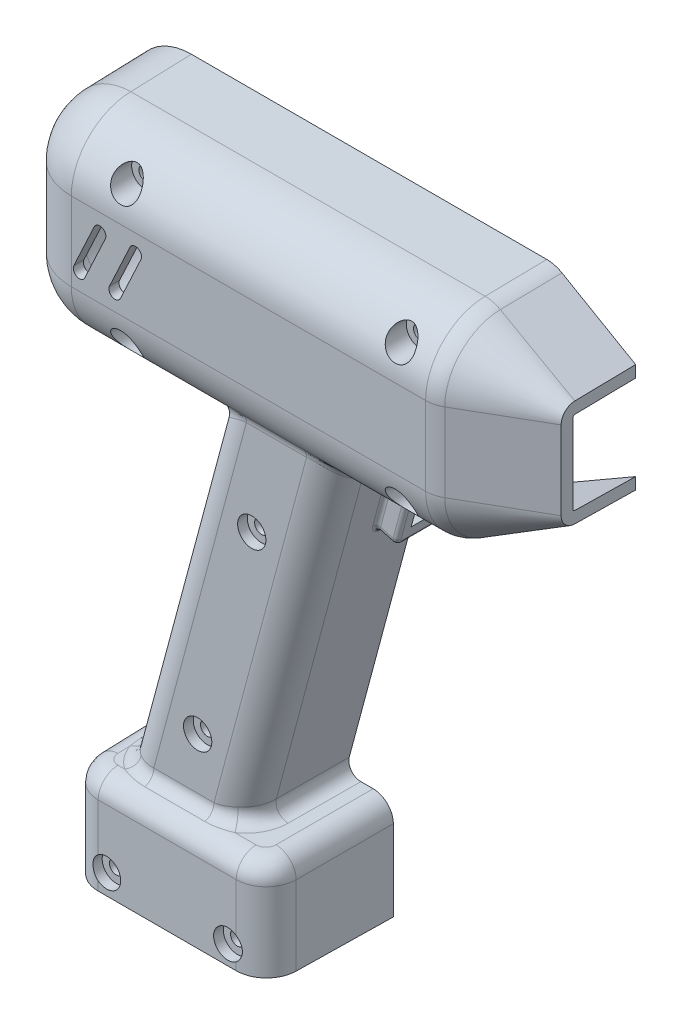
SolidWorks part; units mm, degrees
ref_plane "Ebene vorne" through (0, 0, 0) normal (0, 0, 1) x (1, 0, 0)
ref_plane "Ebene oben" through (0, 0, 0) normal (0, 1, 0) x (1, 0, 0)
ref_plane "Ebene rechts" through (0, 0, 0) normal (1, 0, 0) x (0, 0, -1)
sketch "Skizze1" plane through (0, 0, 0) normal (0, 0, 1) x (1, 0, 0)
  line L0 (55, 0) -> (-55, 0) construction
  line L1 (-25, 0) -> (25, 0)
  line L2 (-25, 0) -> (-25, 25)
  line L3 (-25, 25) -> (25, 25)
  line L4 (25, 0) -> (25, 25)
  line L5 (0, -9.5998) -> (0, 35.5758) construction
  line L6 (0, -55) -> (0, 55) construction
  dimension "D1" = 50
  dimension "D2" = 25
extrude "Aufsatz-Linear austragen1" add sketch "Skizze1" along normal blind 31
sketch "Skizze2" plane through (0, 0, 0) normal (0, 0, 1) x (1, 0, 0)
  line L0 (25, 25) -> (-25, 25) construction
  line L1 (-18, 25) -> (13.0583, 25)
  line L2 (-18, 25) -> (4.7757, 110)
  line L3 (4.7757, 110) -> (35.834, 110)
  line L4 (13.0583, 25) -> (35.834, 110)
  line L5 (0, -13.75) -> (0, 13.75) construction
  point P6 (29.2725, 110)
  point P7 (-16.7981, 25)
  point P11 (0, 60.8353)
  dimension "D1" = 30
  dimension "D2" = 85
  dimension "D3" = 18
  dimension "D4" = 75
extrude "Aufsatz-Linear austragen2" add sketch "Skizze2" along normal blind 25
sketch "Skizze3" plane through (0, 0, 0) normal (0, 0, 1) x (1, 0, 0)
  line L2 (35.834, 110) -> (4.7757, 110) construction
  line L3 (-40, 110) -> (85, 110)
  line L4 (-40, 110) -> (-40, 160)
  line L7 (-40, 160) -> (85, 160)
  line L8 (85, 110) -> (85, 160)
  line L9 (0, -13.75) -> (0, 13.75) construction
  dimension "D1" = 50
  dimension "D2" = 85
  dimension "D3" = 40
extrude "Aufsatz-Linear austragen3" add sketch "Skizze3" along normal blind 30
sketch "Skizze4" plane through (5.9335, -1.5899, 0) normal (0.9659, -0.2588, 0) x (0, 0, -1)
  line L0 (0, 68.75) -> (0, -68.75) construction
  line L1 (0, 95.6186) -> (-10, 95.6186)
  line L2 (0, 95.6186) -> (0, 120.6186)
  line L3 (0, 120.6186) -> (-10, 120.6186)
  line L4 (-10, 95.6186) -> (-10, 120.6186)
  line L5 (-31, 30.6186) -> (0, 30.6186) construction
  point P6 (0, 108.1186)
  point P8 (-13.4172, 107.3742)
  dimension "D1" = 10
  dimension "D2" = 25
  dimension "D3" = 65
extrude "Aufsatz-Linear austragen4" add sketch "Skizze4" along normal blind 5
draft "Formschräge1" type of draft neutral plane draft angle 1 faces to draft 8 parameters "D1"=1
fillet "Verrundung1" radius 15 2 edges at (22.7618, 159.4763, 30) (22.7618, 110.5237, 30)
fillet "Verrundung2" radius 15 5 edges at (-39.8668, 159.8668, 7.6309) (-39.5514, 155.2495, 25.6988) (-39.8668, 110.1332, 7.6309) (-39.5514, 114.7505, 25.6988) (-39.4763, 135, 30)
chamfer "Fase1" distance 20 angle 30 5 edges at (85, 110.1332, 7.6309) (85, 159.8668, 7.6309) (85, 114.7505, 25.6988) (85, 155.2495, 25.6988) (85, 135, 30)
fillet "Verrundung4" radius 7.5 5 edges at (65, 110.1332, 7.6309) (65, 114.7505, 25.6988) (65, 159.8668, 7.6309) (65, 155.2495, 25.6988) (65, 135, 30)
fillet "Verrundung3" radius 7.5 4 edges at (-5.6717, 69.3237, 25) (24.483, 69.3237, 25) (-24.4589, 12.2294, 31) (24.4589, 12.2294, 31)
fillet "Verrundung5" radius 5 5 edges at (-24.7938, 24.7938, 11.8154) (-22.3455, 24.4964, 28.8494) (0, 24.4589, 31) (22.3455, 24.4964, 28.8494) (24.7938, 24.7938, 11.8154)
fillet "Verrundung6" radius 3 12 edges at (-17.8819, 24.8461, 8.8154) (-15.4671, 24.6012, 22.8494) (-2.5878, 24.5636, 25) (10.3117, 24.6012, 22.8494) (12.8578, 24.8461, 8.8154) (35.6648, 110.2205, 12.6309) (35.6263, 110.3344, 16.4509) (33.9697, 112.4043, 22.7218) (21.3991, 114.0838, 25) (6.9878, 111.8847, 21.7817) (5.1626, 110.3344, 16.4509) (4.9493, 110.1332, 7.6309)
fillet "Verrundung7" radius 1.5 1 edges at (33.012, 90.1461, 10)
fillet "Verrundung8" radius 1 3 edges at (35.5111, 89.4765, 4.25) (35.6248, 89.9009, 9.5607) (38.4782, 100.55, 10)
fillet "Verrundung9" radius 1 7 edges at (41.0314, 110.0785, 4.5) (40.7525, 110.1694, 9.7071) (39.0118, 110.1746, 10) (36.1756, 109.5547, 10) (30.6098, 90.7898, 4.25) (30.634, 91.2382, 9.5607) (33.0027, 100.108, 10)
shell "Schale1" thickness 2.5
sketch "Skizze5" plane through (0, 0, 30) normal (0, 0, 1) x (1, 0, 0)
  line L0 (-22.7539, 129.4969) -> (-17.6824, 140.3726) construction
  line L1 (-24.1133, 130.1308) -> (-19.0419, 141.0065)
  line L2 (-21.3944, 128.863) -> (-16.323, 139.7387)
  line L3 (-13.9268, 129.4969) -> (-8.8554, 140.3726) construction
  line L4 (-15.2863, 130.1308) -> (-10.2149, 141.0065)
  line L5 (-12.5674, 128.863) -> (-7.4959, 139.7387)
  line L6 (-48.7499, 134.9347) -> (25.9677, 134.9347) construction
  arc A0 (-24.1133, 130.1308) -> (-21.3944, 128.863) centre (-22.7539, 129.4969) ccw
  arc A1 (-16.323, 139.7387) -> (-19.0419, 141.0065) centre (-17.6824, 140.3726) ccw
  arc A2 (-15.2863, 130.1308) -> (-12.5674, 128.863) centre (-13.9268, 129.4969) ccw
  arc A3 (-7.4959, 139.7387) -> (-10.2149, 141.0065) centre (-8.8554, 140.3726) ccw
  point P2 (-20.2181, 134.9347)
  point P7 (-11.3911, 134.9347)
  point P16 (0, 0)
  point P17 (0, 0)
  point P20 (0, 0)
  point P21 (0, 0)
  point P22 (0, 0)
  dimension "D1" = 12
  dimension "D2" = 12
  dimension "D3" = 8
  dimension "D4" = 3
  dimension "D5" = 3
  dimension "D6" = 65
extrude "Schnitt-Linear austragen1" cut sketch "Skizze5" against normal up to surface (2.5 mm away)
sketch "Skizze6" plane through (10.7632, -2.884, 0) normal (0.9659, -0.2588, 0) x (0, 0, -1)
  line L0 (0, 96.6186) -> (0, 116.0986) construction
  line L1 (0, 99.1186) -> (-7, 99.1186)
  line L2 (0, 99.1186) -> (0, 115.1617)
  line L3 (0, 115.1617) -> (-7, 115.1617)
  line L4 (-7, 99.1186) -> (-7, 115.1617)
  line L5 (-8.5, 96.6186) -> (0, 96.6186) construction
  line L6 (0, 116.0986) -> (-9, 116.2613) construction
  point P6 (0, 107.1402)
  point P9 (-3.5, 99.1186)
  point P12 (-3.5, 115.1617)
  dimension "D1" = 7
  dimension "D2" = 2.5
  dimension "D3" = 1
extrude "Schnitt-Linear austragen2" cut sketch "Skizze6" against normal up to surface (2.5 mm away)
sketch "Skizze7" plane through (0, 0, 0) normal (0, 0, -1) x (-1, 0, 0)
  line L0 (-71.6404, 152) -> (97.6404, 152) construction
  line L1 (-65.4904, 118) -> (-44.5096, 118) construction
  line L2 (-65.4904, 125.2641) -> (-65.4904, 113.4358) construction
  line L3 (-3.721, 48.1082) -> (-26.1707, 131.8918) construction
  line L4 (-33.6495, 5) -> (48.32, 5) construction
  line L5 (-5.5903, 27.2914) -> (-28.506, 112.8142) construction
  line L6 (-13.6117, 112.8142) -> (9.304, 27.2914) construction
  line L7 (17.05, 0) -> (-17.05, 0) construction
  line L8 (-96.83, 135) -> (59.0566, 135) construction
  line L9 (-62.9904, 144.7359) -> (24.7359, 144.7359) construction
  line L10 (24.7359, 125.2641) -> (-62.9904, 125.2641) construction
  line L11 (0, 17.05) -> (0, -17.05) construction
  circle A0 centre (-55, 152) radius 3.5
  circle A1 centre (-55, 118) radius 3.3036
  circle A2 centre (13, 118) radius 3.5
  circle A3 centre (13, 152) radius 3.5
  circle A4 centre (-14.9458, 90) radius 3.5
  circle A5 centre (-1.5484, 40) radius 3.5
  circle A6 centre (-15, 4.7408) radius 3.5
  circle A7 centre (15, 5) radius 3.5
  dimension "D1" = 6.6071
  dimension "D2" = 7
  dimension "D3" = 7
  dimension "D4" = 7
  dimension "D5" = 7
  dimension "D6" = 7
  dimension "D7" = 7
  dimension "D8" = 7
  dimension "D9" = 5
  dimension "D10" = 17
  dimension "D11" = 17
  dimension "D12" = 55
  dimension "D13" = 55
  dimension "D14" = 13
  dimension "D15" = 13
  dimension "D16" = 90
  dimension "D17" = 40
  dimension "D18" = 15
  dimension "D19" = 15
extrude "Aufsatz-Linear austragen5" add sketch "Skizze7" against normal up to next
draft "Formschräge2" type of draft neutral plane draft angle 1 faces to draft 8 parameters "D1"=1
fillet "Verrundung15" radius 0.5 10 edges at (51.0671, 152.182, 25.0402) (-16.9329, 152.182, 25.0402) (51.4575, 119.2502, 25.9582) (-16.7323, 119.3042, 25.9877) (11.0531, 90, 22.5) (-2.3444, 40, 22.5) (18.9888, 4.8724, 28.1249) (-18.9888, 4.8684, 28.1249) (11.0025, 4.7408, 28.5) (-11.0025, 5, 28.5)
sketch "Skizze8" plane through (0, 0, 0) normal (0, 0, -1) x (-1, 0, 0)
  circle A0 centre (-15, 4.7408) radius 1.5
  circle A1 centre (15, 5) radius 1.5
  circle A2 centre (-1.5484, 40) radius 1.5
  circle A3 centre (-14.9458, 90) radius 1.5
  circle A4 centre (13, 118) radius 1.5
  circle A5 centre (13, 152) radius 1.5
  circle A6 centre (-55, 118) radius 1.5
  circle A7 centre (-55, 152) radius 1.5
  circle A9 centre (-55, 152) radius 3.5 construction
  dimension "D1" = 3
  dimension "D2" = 3
  dimension "D3" = 3
  dimension "D4" = 3
  dimension "D5" = 3
  dimension "D6" = 3
  dimension "D7" = 3
  dimension "D8" = 3
extrude "Schnitt-Linear austragen3" cut sketch "Skizze8" against normal through all both and the other way through all
hole_wizard "Stirnsenkung für M3 Flachkopfschraube mit Schlitz3" positions "Skizze10" profile "Skizze11" counterbore size "M3" standard "DIN"
sketch "Skizze10" plane through (0, 0, 31) normal (0, 0, 1) x (1, 0, 0)
  point P0 (-15, 5)
  point P3 (15, 4.7408)
sketch "Skizze11" plane through (-15, 5, 31) normal (1, 0, 0) x (0, -1, 0)
  line L0 (0, 0) -> (0, 31)
  line L1 (0, 31) -> (1.7, 31)
  line L3 (1.7, 31) -> (1.7, 2.4)
  line L4 (1.7, 2.4) -> (3.5, 2.4)
  line L5 (3.5, 2.4) -> (3.5, 0)
  line L7 (3.5, 0) -> (0, 0)
  line L11 (0, -6.35) -> (0, 107.95) construction
  dimension "Bohrerdurchmesser" = 3.4
  dimension "Bohrungstiefe" = 31
  dimension "Senkdurchmesser2" = 7
  dimension "Senktiefe2" = 2.4
hole_wizard "Stirnsenkung für M3 Flachkopfschraube mit Schlitz2" positions "Skizze12" profile "Skizze13" counterbore size "M3" standard "DIN"
sketch "Skizze12" plane through (0, 0, 25) normal (0, 0, 1) x (1, 0, 0)
  point P0 (14.9458, 90)
  point P3 (1.5484, 40)
sketch "Skizze13" plane through (14.9458, 90, 25) normal (1, 0, 0) x (0, -1, 0)
  line L0 (0, 0) -> (0, 25)
  line L1 (0, 25) -> (1.7, 25)
  line L3 (1.7, 25) -> (1.7, 2.4)
  line L4 (1.7, 2.4) -> (3.5, 2.4)
  line L5 (3.5, 2.4) -> (3.5, 0)
  line L7 (3.5, 0) -> (0, 0)
  line L11 (0, -6.35) -> (0, 107.95) construction
  dimension "Bohrerdurchmesser" = 3.4
  dimension "Bohrungstiefe" = 25
  dimension "Senkdurchmesser2" = 7
  dimension "Senktiefe2" = 2.4
hole_wizard "Stirnsenkung für M3 Flachkopfschraube mit Schlitz1" positions "Skizze14" profile "Skizze16" counterbore size "M3" standard "DIN"
sketch "Skizze14" plane through (0, 0, 30) normal (0, 0, 1) x (1, 0, 0)
  point P0 (55, 118)
  point P3 (55, 152)
  point P6 (-13, 118)
  point P9 (-13, 152)
sketch "Skizze16" plane through (55, 118, 30) normal (1, 0, 0) x (0, -1, 0)
  line L0 (0, 0) -> (0, 30)
  line L1 (0, 30) -> (1.7, 30)
  line L3 (1.7, 30) -> (1.7, 6.7)
  line L4 (1.7, 6.7) -> (3.5, 6.7)
  line L5 (3.5, 6.7) -> (3.5, 0)
  line L7 (3.5, 0) -> (0, 0)
  line L11 (0, -6.35) -> (0, 107.95) construction
  dimension "Bohrerdurchmesser" = 3.4
  dimension "Bohrungstiefe" = 30
  dimension "Senkdurchmesser2" = 7
  dimension "Senktiefe2" = 6.7
sketch "Skizze17" plane through (0, 0, 0) normal (0, 0, -1) x (-1, 0, 0)
  line L0 (-41.7777, 110) -> (-62.9904, 110) construction
  line L1 (-47, 110) -> (-45, 110)
  line L2 (-47, 110) -> (-47, 157.4996)
  line L3 (-47, 157.4996) -> (-45, 157.4996)
  line L4 (-45, 110) -> (-45, 157.4996)
  line L5 (-62.9904, 157.4996) -> (25.0015, 157.4996) construction
  line L6 (25.0023, 110) -> (-0.8666, 110) construction
  line L7 (2, 110) -> (0, 110)
  line L8 (2, 110) -> (2, 160)
  line L9 (2, 160) -> (0, 160)
  line L10 (0, 110) -> (0, 160)
  line L11 (0, 17.05) -> (0, -17.05) construction
  line L12 (-62.9904, 160) -> (25.0023, 160) construction
  line L13 (-25, 0) -> (-25, 20.0008) construction
  line L14 (-25, 12) -> (25, 12)
  line L15 (-25, 12) -> (-25, 14)
  line L16 (-25, 14) -> (25, 14)
  line L17 (25, 12) -> (25, 14)
  line L18 (17.05, 0) -> (-17.05, 0) construction
  line L19 (25, 20.0008) -> (25, 0) construction
  line L21 (-19.757, 50) -> (10.7654, 50)
  line L22 (-19.757, 50) -> (-19.757, 52)
  line L23 (-19.757, 52) -> (10.7654, 52)
  line L24 (10.7654, 50) -> (10.7654, 52)
  line L25 (-3.7639, 106.2241) -> (17.4058, 27.2175) construction
  line L26 (-27.7955, 80) -> (2.7269, 80)
  line L27 (-27.7955, 80) -> (-27.7955, 82)
  line L28 (-27.7955, 82) -> (2.7269, 82)
  line L29 (2.7269, 80) -> (2.7269, 82)
  line L30 (-14.07, 28.7759) -> (-30.4226, 89.8047) construction
  point P26 (25, 13)
  point P33 (0, 0)
  point P41 (0, 0)
  point P43 (0, 0)
  point P44 (0, 0)
  dimension "D1" = 2
  dimension "D2" = 2
  dimension "D3" = 2
  dimension "D4" = 45
  dimension "D5" = 12
  dimension "D6" = 0
  dimension "D7" = 50
  dimension "D8" = 80
  dimension "D9" = 2
  dimension "D10" = 2
extrude "Aufsatz-Linear austragen6" add sketch "Skizze17" against normal up to next
sketch "Skizze19" plane through (0, 12, 0) normal (0, -1, 0) x (1, 0, 0)
  line L1 (0, -6) -> (0, 10) construction
  line L2 (0, -17.05) -> (0, 17.05) construction
  line L3 (-9.5, -6) -> (-9.5, 10)
  line L4 (9.5, -6) -> (9.5, 10)
  line L5 (68.75, 0) -> (-68.75, 0) construction
  arc A0 (-9.5, -6) -> (9.5, -6) centre (0, -6) ccw
  arc A1 (9.5, 10) -> (-9.5, 10) centre (0, 10) ccw
  point P4 (0, 2)
  dimension "D1" = 19
  dimension "D2" = 10
  dimension "D3" = 6
extrude "Schnitt-Linear austragen4" cut sketch "Skizze19" against normal up to surface (2 mm away)
sketch "Skizze20" plane through (-2, 0, 0) normal (-1, 0, 0) x (0, 0, 1)
  line L0 (0, 133.5) -> (0, 136.5) construction
  line L1 (0, 112.5004) -> (0, 157.4996) construction
  line L2 (-18, 133.5) -> (-18, 136.5)
  line L3 (18, 133.5) -> (18, 136.5)
  line L4 (32.7029, 135) -> (-32.7029, 135) construction
  line L5 (15.2182, 112.766) -> (0, 112.5004) construction
  line L6 (0, 157.4996) -> (15.2182, 157.234) construction
  arc A0 (-18, 133.5) -> (18, 133.5) centre (0, 133.5) ccw
  arc A1 (18, 136.5) -> (-18, 136.5) centre (0, 136.5) ccw
  point P4 (0, 135)
  point P15 (0, 0)
  dimension "D1" = 3
  dimension "D2" = 18
extrude "Schnitt-Linear austragen5" cut sketch "Skizze20" against normal up to surface (49 mm away)
sketch "Skizze21" plane through (0, 82, 0) normal (0, 1, 0) x (1, 0, 0)
  line L0 (-0.1383, 0) -> (25.7428, 0) construction
  circle A0 centre (12.8022, 0) radius 10
  point P2 (0, 0)
  dimension "D1" = 20
extrude "Schnitt-Linear austragen6" cut sketch "Skizze21" against normal up to surface (2 mm away)
sketch "Skizze22" plane through (0, 52, 0) normal (0, 1, 0) x (1, 0, 0)
  line L1 (-8.1768, 0) -> (17.7043, 0) construction
  circle A0 centre (4.7638, 0) radius 10
  point P2 (0, 0)
  dimension "D1" = 20
extrude "Schnitt-Linear austragen7" cut sketch "Skizze22" against normal up to surface (2 mm away)
draft "Formschräge3" type of draft neutral plane draft angle 0.5 faces to draft 10 parameters "D1"=0.5
fillet "Verrundung16" radius 1 50 edges at (22.2938, 11.8971, 11.7936) (20.5932, 11.7638, 27.0663) (0, 11.7513, 28.5) (-20.5932, 11.7638, 27.0663) (16.989, 49.9233, 8.7936) (15.2539, 49.8162, 21.0663) (4.1753, 49.8036, 22.5) (-6.8967, 49.8162, 21.0663) (25.0274, 79.9233, 8.7936) (23.2924, 79.8162, 21.0663) (12.2137, 79.8036, 22.5) (1.1418, 79.8162, 21.0663) (22.2938, 14.1029, 11.7936) (20.5932, 14.2362, 27.0663) (0, 14.2487, 28.5) (-20.5932, 14.2362, 27.0663) (17.566, 52.0767, 8.7936) (15.8884, 52.1838, 21.0663) (4.8164, 52.1964, 22.5) (-6.2623, 52.1838, 21.0663) (25.6045, 82.0767, 8.7936) (23.9268, 82.1838, 21.0663) (12.8549, 82.1964, 22.5) (1.7762, 82.1838, 21.0663) (0.0664, 157.3668, 7.6091) (0.2087, 153.4973, 23.9156) (0.24, 135, 27.5) (0.2087, 116.5027, 23.9156) (-2.0664, 157.3668, 7.6091) (-2.2087, 153.4973, 23.9156) (-2.24, 135, 27.5) (-2.2087, 116.5027, 23.9156) (44.9336, 157.3668, 7.6091) (44.7913, 153.4973, 23.9156) (44.76, 135, 27.5) (44.7913, 116.5027, 23.9156) (47.0664, 157.3668, 7.6091) (47.2087, 153.4973, 23.9156) (47.24, 135, 27.5) (47.2087, 116.5027, 23.9156) (-22.2938, 11.8971, 11.7936) (-8.5743, 49.9233, 8.7936) (-0.5359, 79.9233, 8.7936) (-22.2938, 14.1029, 11.7936) (-7.9973, 52.0767, 8.7936) (0.0412, 82.0767, 8.7936) (0.0664, 112.6332, 7.6091) (-2.0664, 112.6332, 7.6091) (44.9336, 112.6332, 7.6091) (47.0664, 112.6332, 7.6091)
